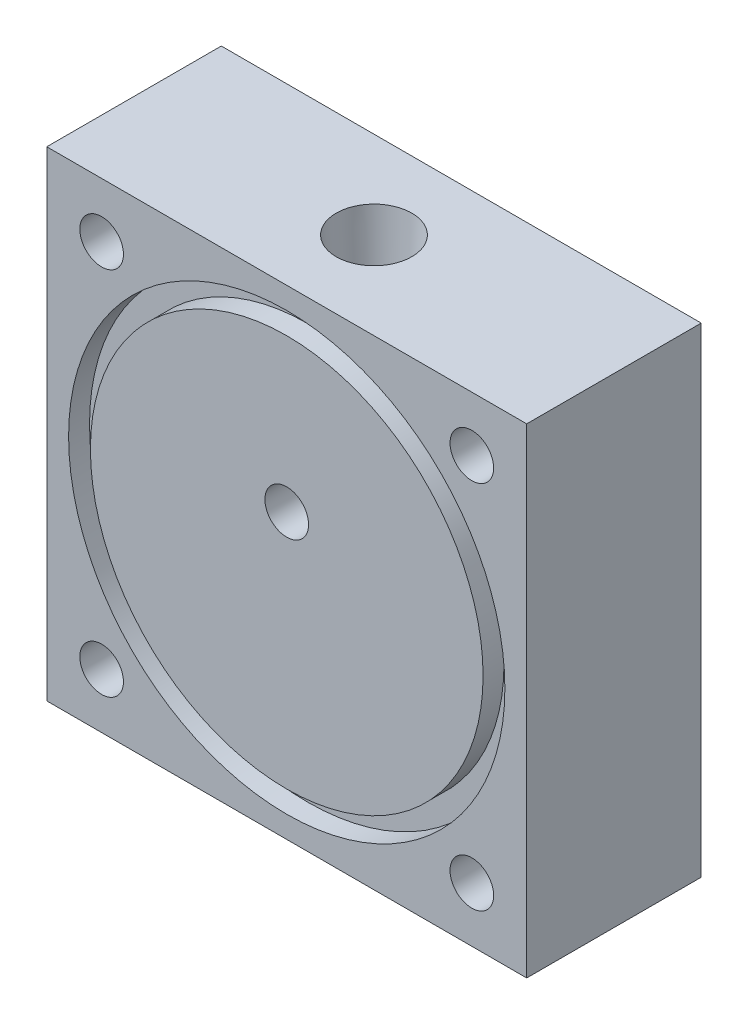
SolidWorks part; units mm, degrees
ref_plane "Front" through (0, 0, 0) normal (0, 0, 1) x (1, 0, 0)
ref_plane "Top" through (0, 0, 0) normal (0, 1, 0) x (1, 0, 0)
ref_plane "Right" through (0, 0, 0) normal (1, 0, 0) x (0, 0, -1)
sketch "Sketch1" plane through (0, 0, 0) normal (0, 0, 1) x (1, 0, 0)
  line L0 (-17.4625, 17.4625) -> (17.4625, 17.4625)
  line L1 (-17.4625, 17.4625) -> (-17.4625, -17.4625)
  line L2 (17.4625, -17.4625) -> (-17.4625, -17.4625)
  line L3 (17.4625, -17.4625) -> (17.4625, 17.4625)
  line L4 (17.4625, 17.4625) -> (-17.4625, -17.4625) construction
  dimension "D1" = 34.925
extrude "Base-Extrude" add sketch "Sketch1" along normal blind 12.7
sketch "Sketch2" plane through (0, 0, 12.7) normal (0, 0, 1) x (1, 0, 0)
  circle A0 centre (0, 0) radius 14.2875
  circle A1 centre (0, 0) radius 15.875
  dimension "D1" = 28.575
  dimension "D2" = 31.75
extrude "Cut-Extrude1" cut sketch "Sketch2" against normal blind 1.524
sketch "Sketch3" plane through (0, 0, 12.7) normal (0, 0, 1) x (1, 0, 0)
  line L0 (0, 0) -> (17.4625, 17.4625) construction
  circle A0 centre (13.4704, 13.4704) radius 1.5875
  circle A1 centre (0, 0) radius 19.05 construction
  dimension "D1" = 3.175
  dimension "D2" = 38.1
extrude "Cut-Extrude2" cut sketch "Sketch3" against normal through all
pattern_circular "CirPattern1" count 4 every 90 about axis through (0, 0, 0) along (0, 0, 1) of "Cut-Extrude2"
hole_wizard "Hole3" positions "Sketch9" profile "Sketch10" legacy
sketch "Sketch9" plane through (5.4711, 17.4625, 3.5795) normal (0, 1, 0) x (-1, 0, 0)
  line L0 (5.4711, 7.5965) -> (5.4711, 9.1205) construction
  line L1 (5.4711, 2.7705) -> (22.9336, 2.7705) construction
  line L3 (22.9336, 9.1205) -> (22.9336, -3.5795) construction
  point P0 (5.4711, 2.7705)
sketch "Sketch10" plane through (0, 17.4625, 6.35) normal (1, 0, 0) x (0, 0, 1)
  line L0 (0, 0) -> (0, 17.3249)
  line L1 (0, 17.3249) -> (2.413, 15.875)
  line L2 (2.413, 15.875) -> (2.413, 4.826)
  line L4 (2.7505, 0) -> (0, 0)
  line L5 (0, -4.0065) -> (0, 25.3083) construction
  line L6 (0, 17.3249) -> (-2.413, 15.875) construction
  line L7 (2.413, 4.826) -> (2.7505, 0)
  dimension "Depth" = 15.875
  dimension "Drill Angle" = 118
  dimension "Diameter" = 4.826
sketch "Sketch11" plane through (0, 0, 12.7) normal (0, 0, 1) x (1, 0, 0)
  line L0 (0, 0) -> (0, 3.175) construction
  circle A0 centre (0, 3.175) radius 1.5875
  dimension "D1" = 3.175
  dimension "D2" = 3.175
extrude "Cut-Extrude3" cut sketch "Sketch11" against normal up to next
